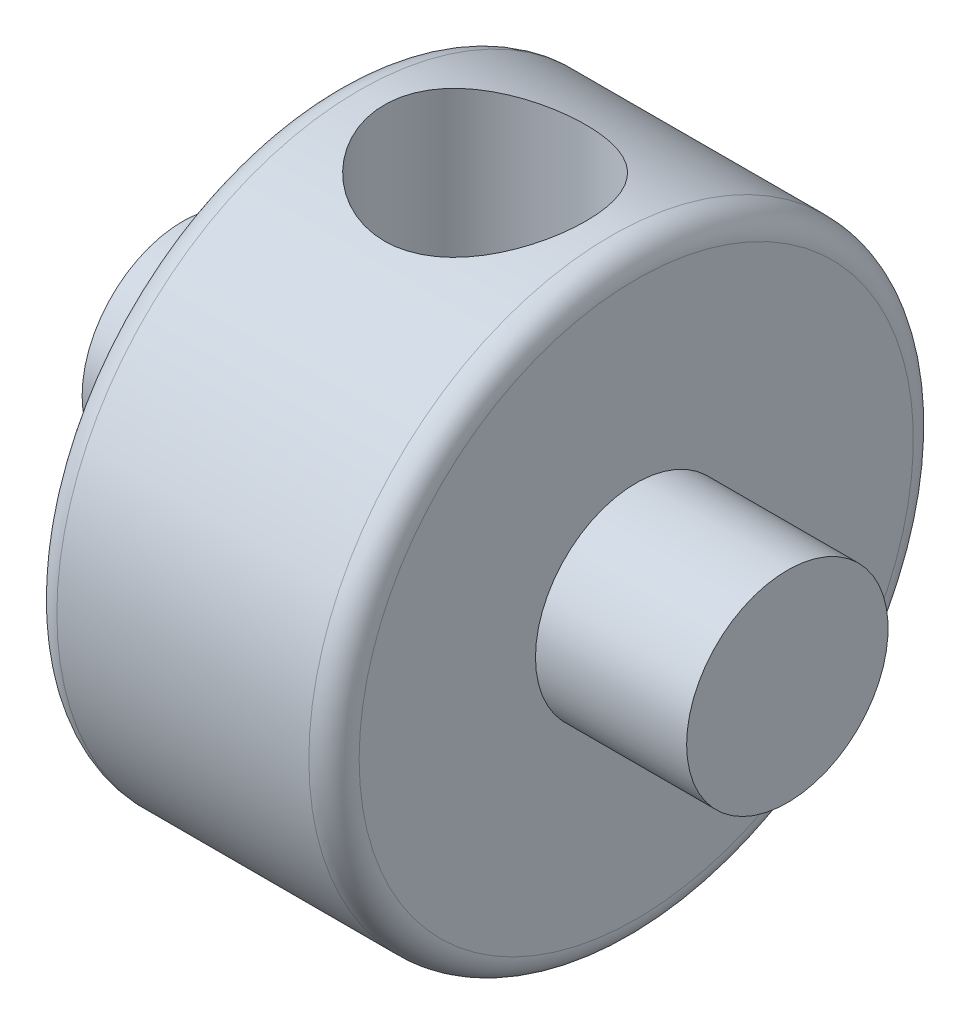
SolidWorks part; units mm, degrees
ref_plane "Front Plane" through (0, 0, 0) normal (0, 0, 1) x (1, 0, 0)
ref_plane "Top Plane" through (0, 0, 0) normal (0, 1, 0) x (1, 0, 0)
ref_plane "Right Plane" through (0, 0, 0) normal (1, 0, 0) x (0, 0, -1)
sketch "Sketch1" plane through (0, 0, 0) normal (0, 0, 1) x (1, 0, 0)
  line L0 (-9.525, 0) -> (-9.525, 3.175)
  line L1 (-9.525, 3.175) -> (-4.7625, 3.175)
  line L2 (-4.7625, 3.175) -> (-4.7625, 9.525)
  line L3 (-4.7625, 9.525) -> (4.7625, 9.525)
  line L4 (4.7625, 9.525) -> (4.7625, 3.175)
  line L5 (4.7625, 3.175) -> (9.525, 3.175)
  line L6 (9.525, 3.175) -> (9.525, 0)
  line L7 (9.525, 0) -> (-9.525, 0)
  line L8 (-58.3897, 0) -> (112.59, 0) construction
  dimension "D1" = 19.05
  dimension "D2" = 4.7625
  dimension "D3" = 19.05
  dimension "D4" = 6.35
revolve "Revolve1" add sketch "Sketch1" angle 360 about L8
fillet "Fillet1" radius 0.7925 2 edges at (-4.7625, 0, 9.525) (4.7625, 0, 9.525)
hole_wizard "#97 (0.0059) Diameter Hole1" positions "3DSketch1" profile "Sketch2" hole size "#97" standard "Ansi Inch"
sketch3d "3DSketch1"
  point P0 (0, 9.525, 0)
sketch "Sketch2" plane through (0, 9.525, 0) normal (1, 0, 0) x (0, 0, 1)
  line L0 (0, 0) -> (0, 19.05)
  line L1 (0, 19.05) -> (3.175, 19.05)
  line L2 (3.175, 19.05) -> (3.175, 0)
  line L5 (3.175, 0) -> (0, 0)
  line L11 (0, -6.35) -> (0, 107.95) construction
  dimension "Thru Hole Dia." = 6.35
  dimension "Thru Hole Depth" = 19.05
